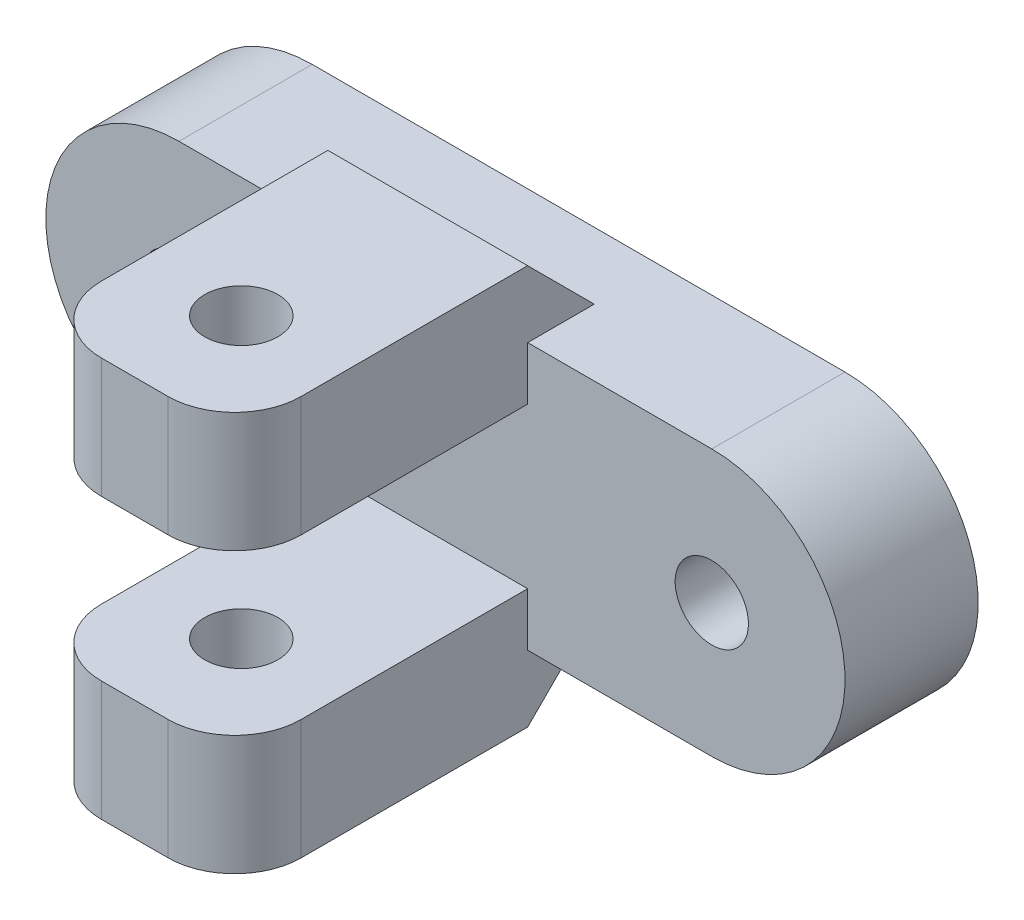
SolidWorks part; units mm, degrees
ref_plane "Plan de face" through (0, 0, 0) normal (0, 0, 1) x (1, 0, 0)
ref_plane "Plan de dessus" through (0, 0, 0) normal (0, 1, 0) x (1, 0, 0)
ref_plane "Plan de droite" through (0, 0, 0) normal (1, 0, 0) x (0, 0, -1)
sketch "Esquisse1" plane through (0, 0, 0) normal (0, 0, 1) x (1, 0, 0)
  line L0 (-59.1949, 0) -> (-19.1949, 0) construction
  line L1 (-59.1949, 10) -> (-19.1949, 10)
  line L2 (-59.1949, -10) -> (-19.1949, -10)
  arc A0 (-59.1949, 10) -> (-59.1949, -10) centre (-59.1949, 0) ccw
  arc A1 (-19.1949, -10) -> (-19.1949, 10) centre (-19.1949, 0) ccw
  point P3 (-39.1949, 0)
  dimension "D1" = 40
  dimension "D2" = 20
extrude "Boss.-Extru.1" add sketch "Esquisse1" against normal blind 10
sketch "Esquisse2" plane through (0, 0, 0) normal (0, 0, 1) x (1, 0, 0)
  circle A0 centre (-19.1949, 0) radius 2.75
  dimension "D1" = 5.5
extrude "Enlèv. mat.-Extru.1" cut sketch "Esquisse2" against normal blind 10
sketch "Esquisse3" plane through (0, 0, 0) normal (0, 0, 1) x (1, 0, 0)
  circle A0 centre (-59.1949, 0) radius 2.75
  dimension "D1" = 5.5
extrude "Enlèv. mat.-Extru.2" cut sketch "Esquisse3" against normal blind 10
sketch "Esquisse4" plane through (0, 0, 0) normal (0, 0, 1) x (1, 0, 0)
  line L0 (-19.1949, 10) -> (-59.1949, 10) construction
  line L1 (-48.0189, 15) -> (-33.0189, 15)
  line L2 (-48.0189, 15) -> (-48.0189, -15)
  line L3 (-48.0189, -15) -> (-33.0189, -15)
  line L4 (-33.0189, 15) -> (-33.0189, -15)
  line L5 (-59.1949, -10) -> (-19.1949, -10) construction
  dimension "D1" = 15
  dimension "D2" = 30
  dimension "D3" = 5
  dimension "D4" = 5
extrude "Boss.-Extru.2" add sketch "Esquisse4" along normal blind 30
sketch "Esquisse5" plane through (0, 0, 30) normal (0, 0, 1) x (1, 0, 0)
  line L0 (-33.0189, 15) -> (-48.0189, 15) construction
  line L1 (-49.2845, 6) -> (-30.9112, 6)
  line L2 (-49.2845, 6) -> (-49.2845, -6)
  line L3 (-49.2845, -6) -> (-30.9112, -6)
  line L4 (-30.9112, 6) -> (-30.9112, -6)
  line L5 (-48.0189, -15) -> (-33.0189, -15) construction
  dimension "D1" = 12
  dimension "D2" = 9
  dimension "D3" = 9
extrude "Enlèv. mat.-Extru.3" cut sketch "Esquisse5" against normal blind 30
sketch "Esquisse6" plane through (0, -15, 0) normal (0, -1, 0) x (1, 0, 0)
  line L0 (-48.0189, 0) -> (-33.0189, 0) construction
  line L1 (-33.0189, 30) -> (-33.0189, 0) construction
  line L2 (-48.0189, 30) -> (-48.0189, 0) construction
  circle A0 centre (-40.5189, 14) radius 2.75
  dimension "D1" = 5.5
  dimension "D2" = 14
  dimension "D3" = 7.5
  dimension "D4" = 7.5
extrude "Enlèv. mat.-Extru.4" cut sketch "Esquisse6" against normal through all
sketch "Esquisse7" plane through (0, 0, 30) normal (0, 0, 1) x (1, 0, 0)
  line L1 (-52.2814, 17.3733) -> (-29.6844, 17.3733)
  line L2 (-52.2814, 17.3733) -> (-52.2814, -22.6361)
  line L3 (-52.2814, -22.6361) -> (-29.6844, -22.6361)
  line L4 (-29.6844, 17.3733) -> (-29.6844, -22.6361)
extrude "Enlèv. mat.-Extru.5" cut sketch "Esquisse7" against normal blind 8
chamfer "Chanfrein1" distance 5 angle 45 1 edges at (-40.5189, -10, 0)
chamfer "Chanfrein2" distance 5 angle 45 1 edges at (-40.5189, 10, 0)
fillet "Congé1" radius 5 1 edges at (-33.0189, -10.5, 22)
fillet "Congé2" radius 5 1 edges at (-48.0189, -10.5, 22)
fillet "Congé3" radius 5 1 edges at (-33.0189, 10.5, 22)
fillet "Congé4" radius 5 1 edges at (-48.0189, 10.5, 22)
